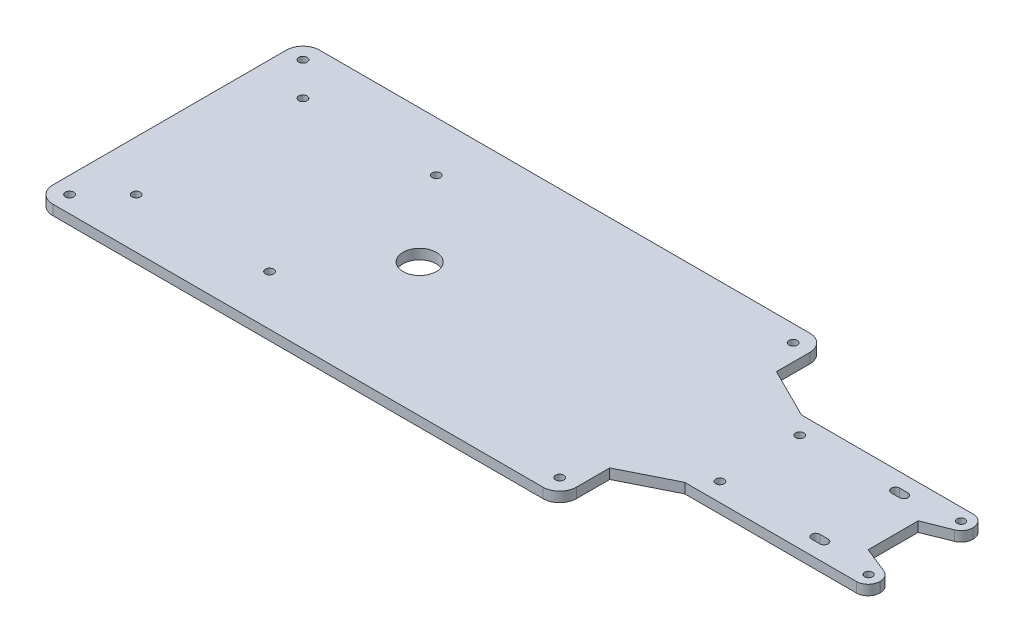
SolidWorks part; units mm, degrees
ref_plane "Front Plane" through (0, 0, 0) normal (0, 0, 1) x (1, 0, 0)
ref_plane "Top Plane" through (0, 0, 0) normal (0, 1, 0) x (1, 0, 0)
ref_plane "Right Plane" through (0, 0, 0) normal (1, 0, 0) x (0, 0, -1)
sketch "Sketch1" plane through (0, 0, 0) normal (0, 1, 0) x (1, 0, 0)
  line L0 (0, 0) -> (41449.7842, 0) construction
  line L1 (0, -30) -> (0, 30)
  line L2 (0, 30) -> (65, 30) construction
  line L3 (65, 30) -> (77, 40) construction
  line L4 (77, 40) -> (157, 40)
  line L5 (157, 40) -> (157, 25)
  line L6 (157, 25) -> (172, 17.5)
  line L7 (172, 17.5) -> (223.5, 17.5)
  line L8 (217, 7.5) -> (217, -7.5)
  line L9 (217, 7.5) -> (224.7999, 10.6199)
  line L10 (227, 13.8696) -> (227, 14)
  line L11 (217, -7.5) -> (224.7999, -10.6199)
  line L12 (227, -13.8696) -> (227, -14)
  line L13 (172, -17.5) -> (223.5, -17.5)
  line L14 (157, -25) -> (172, -17.5)
  line L15 (157, -40) -> (157, -25)
  line L16 (77, -40) -> (157, -40)
  line L17 (65, -30) -> (77, -40) construction
  line L18 (0, -30) -> (65, -30) construction
  line L19 (77, 40) -> (0, 40)
  line L20 (0, 40) -> (0, 30)
  line L21 (0, -30) -> (0, -40)
  line L22 (0, -40) -> (77, -40)
  arc A1 (223.5, 17.5) -> (227, 14) centre (223.5, 14) cw
  arc A2 (224.7999, 10.6199) -> (227, 13.8696) centre (223.5, 13.8696) ccw
  circle A4 centre (223.5, -13.8696) radius 1.2
  arc A5 (224.7999, -10.6199) -> (227, -13.8696) centre (223.5, -13.8696) cw
  arc A6 (223.5, -17.5) -> (227, -14) centre (223.5, -14) ccw
  circle A7 centre (223.5, 13.8696) radius 1.2
  point P6 (0, 0)
  point P17 (217, 0)
  point P18 (227, 17.5)
  point P21 (227, 11.5)
  point P35 (0, 0)
  point P38 (0, 0)
  point P39 (0, 0)
  dimension "D14" = 3.5
  dimension "D16" = 2.4
  dimension "D17" = 2.4
  dimension "D2" = 65
  dimension "D3" = 12
  dimension "D4" = 80
  dimension "D5" = 35
  dimension "D6" = 10
  dimension "D7" = 80
  dimension "D8" = 30
  dimension "D9" = 15
  dimension "D10" = 15
  dimension "D11" = 55
  dimension "D12" = 10
  dimension "D13" = 6
  dimension "D15" = 15
extrude "Boss-Extrude1" add sketch "Sketch1" along normal blind 3
fillet "Fillet1" radius 5 4 edges at (157, 1.5, 40) (157, 1.5, -40) (0, 1.5, 40) (0, 1.5, -40)
sketch "Sketch2" plane through (0, 3, 0) normal (0, 1, 0) x (1, 0, 0)
  line L1 (15, -25) -> (55, -25) construction
  line L2 (15, -25) -> (15, 25) construction
  line L3 (15, 25) -> (55, 25) construction
  line L4 (55, -25) -> (55, 25) construction
  line L5 (15, -25) -> (55, 25) construction
  line L6 (15, 25) -> (55, -25) construction
  circle A0 centre (15, 25) radius 1.25
  circle A1 centre (55, 25) radius 1.25
  circle A2 centre (55, -25) radius 1.25
  circle A3 centre (15, -25) radius 1.25
  point P0 (35, 0)
  dimension "D1" = 2.5
  dimension "D2" = 2.5
  dimension "D3" = 2.5
  dimension "D4" = 2.5
  dimension "D5" = 50
  dimension "D6" = 40
  dimension "D7" = 35
extrude "Cut-Extrude1" cut sketch "Sketch2" against normal through all both and the other way through all
sketch "Sketch3" plane through (0, 3, 0) normal (0, 1, 0) x (1, 0, 0)
  circle A0 centre (5, 35) radius 1.25
  circle A1 centre (5, -35) radius 1.25
  circle A2 centre (152, 35) radius 1.25
  circle A3 centre (152, -35) radius 1.25
  dimension "D1" = 2.5
  dimension "D2" = 2.5
  dimension "D3" = 2.5
  dimension "D4" = 2.5
extrude "Cut-Extrude2" cut sketch "Sketch3" against normal blind 10
sketch "Sketch4" plane through (0, 3, 0) normal (0, 1, 0) x (1, 0, 0)
  line L0 (217, -7.5) -> (217, 7.5) construction
  line L1 (177.024, -11.975) -> (206.976, -11.975) construction
  line L2 (177.024, -11.975) -> (177.024, 11.975) construction
  line L3 (177.024, 11.975) -> (206.976, 11.975) construction
  line L4 (206.976, -11.975) -> (206.976, 11.975) construction
  line L5 (177.024, -11.975) -> (206.976, 11.975) construction
  line L6 (177.024, 11.975) -> (206.976, -11.975) construction
  line L7 (205.726, 11.975) -> (208.226, 11.975) construction
  line L8 (205.726, 13.225) -> (208.226, 13.225)
  line L9 (205.726, 10.725) -> (208.226, 10.725)
  line L10 (205.726, -11.975) -> (208.226, -11.975) construction
  line L11 (205.726, -10.725) -> (208.226, -10.725)
  line L12 (205.726, -13.225) -> (208.226, -13.225)
  circle A0 centre (177.024, 11.975) radius 1.25
  circle A1 centre (206.976, 11.975) radius 1.25 construction
  circle A2 centre (206.976, -11.975) radius 1.25 construction
  circle A3 centre (177.024, -11.975) radius 1.25
  arc A4 (205.726, 13.225) -> (205.726, 10.725) centre (205.726, 11.975) ccw
  arc A5 (208.226, 10.725) -> (208.226, 13.225) centre (208.226, 11.975) ccw
  arc A6 (205.726, -10.725) -> (205.726, -13.225) centre (205.726, -11.975) ccw
  arc A7 (208.226, -13.225) -> (208.226, -10.725) centre (208.226, -11.975) ccw
  point P0 (192, 0)
  point P11 (217, 0)
  point P13 (206.976, 11.975)
  point P21 (206.976, -11.975)
  dimension "D1" = 2.5
  dimension "D2" = 2.5
  dimension "D3" = 2.5
  dimension "D4" = 2.5
  dimension "D8" = 1.25
  dimension "D9" = 1.25
  dimension "D5" = 38.35
  dimension "D6" = 25
  dimension "D7" = 23.95
extrude "Cut-Extrude3" cut sketch "Sketch4" against normal blind 10
sketch "Sketch5" plane through (0, 3, 0) normal (0, 1, 0) x (1, 0, 0)
  line L0 (0, 0) -> (217, 0) construction
  line L1 (0, 35) -> (0, -35) construction
  line L2 (217, -7.5) -> (217, 7.5) construction
  circle A0 centre (75, 0) radius 5
  dimension "D1" = 10
  dimension "D2" = 75
extrude "Cut-Extrude4" cut sketch "Sketch5" against normal blind 10
